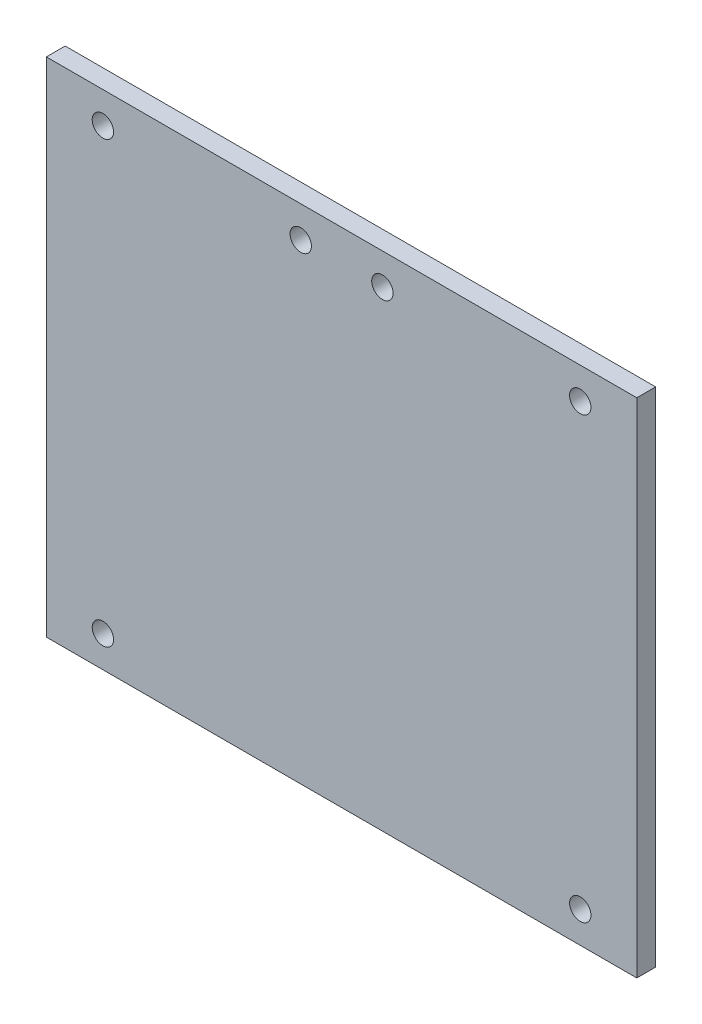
SolidWorks part; units mm, degrees
ref_plane "前视基准面" through (0, 0, 0) normal (0, 0, 1) x (1, 0, 0)
ref_plane "上视基准面" through (0, 0, 0) normal (0, 1, 0) x (1, 0, 0)
ref_plane "右视基准面" through (0, 0, 0) normal (1, 0, 0) x (0, 0, -1)
sketch "草图1" plane through (0, 0, 0) normal (0, 0, 1) x (1, 0, 0)
  line L1 (-47, 40) -> (47, 40)
  line L2 (-47, 40) -> (-47, -40)
  line L3 (-47, -40) -> (47, -40)
  line L4 (47, 40) -> (47, -40)
  line L5 (-47, 40) -> (47, -40) construction
  line L6 (-47, -40) -> (47, 40) construction
  point P0 (0, 0)
  dimension "D1" = 94
  dimension "D2" = 80
extrude "凸台-拉伸1" add sketch "草图1" along normal blind 3
hole_wizard "Ø3.4 (3.4) 直径孔1" positions "草图2" profile "草图3" hole size "Ø3.4" standard "GB"
sketch "草图2" plane through (0, 0, 3) normal (0, 0, 1) x (1, 0, 0)
  point P0 (-6.5, 35)
  point P3 (6.5, 35)
sketch "草图3" plane through (-6.5, 35, 3) normal (1, 0, 0) x (0, -1, 0)
  line L0 (0, 0) -> (0, 3)
  line L1 (0, 3) -> (1.7, 3)
  line L2 (1.7, 3) -> (1.7, 0)
  line L5 (1.7, 0) -> (0, 0)
  line L11 (0, -6.35) -> (0, 107.95) construction
  dimension "通孔孔直径" = 3.4
  dimension "通孔孔深度" = 3
hole_wizard "Ø3.4 (3.4) 直径孔2" positions "草图4" profile "草图5" hole size "Ø3.4" standard "GB"
sketch "草图4" plane through (0, 0, 3) normal (0, 0, 1) x (1, 0, 0)
  point P0 (-38, 35)
  point P3 (38, 35)
  point P7 (-38, -35)
  point P10 (38, -35)
sketch "草图5" plane through (-38, 35, 3) normal (1, 0, 0) x (0, -1, 0)
  line L0 (0, 0) -> (0, 3)
  line L1 (0, 3) -> (1.7, 3)
  line L2 (1.7, 3) -> (1.7, 0)
  line L5 (1.7, 0) -> (0, 0)
  line L11 (0, -6.35) -> (0, 107.95) construction
  dimension "通孔孔直径" = 3.4
  dimension "通孔孔深度" = 3
